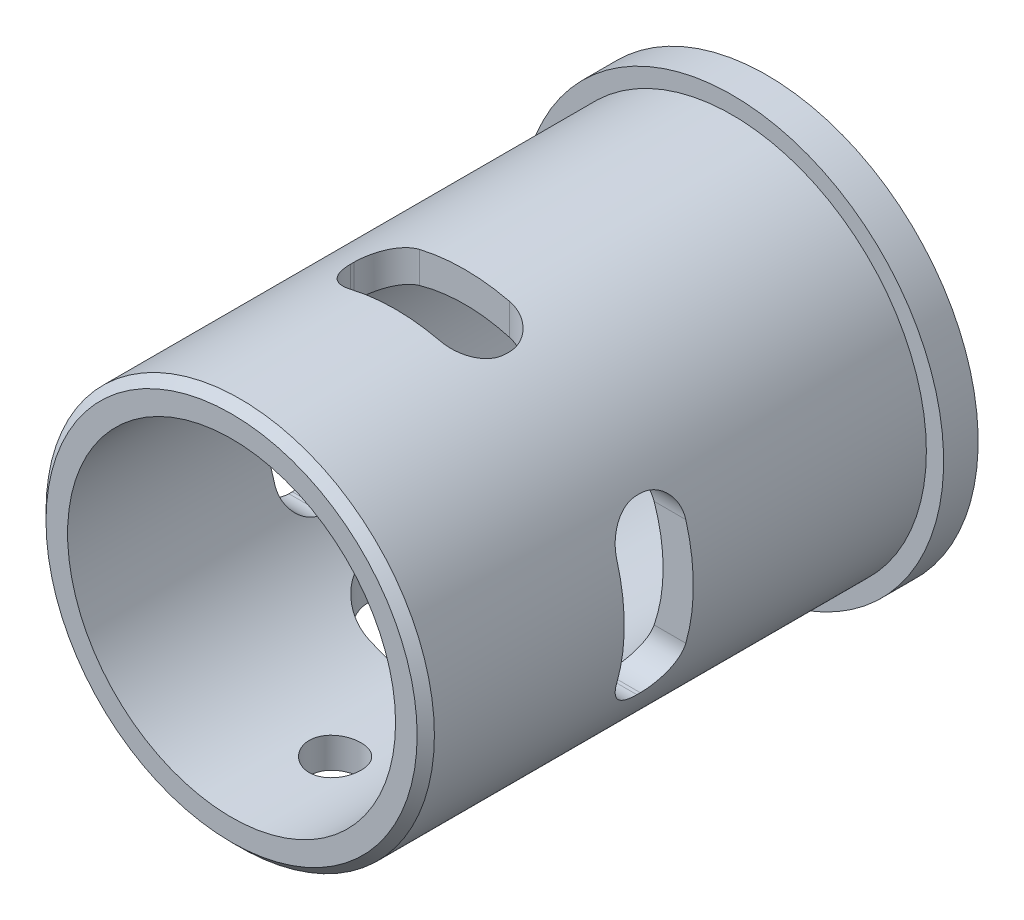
SolidWorks part; units mm, degrees
ref_plane "Face" through (0, 0, 0) normal (0, 0, 1) x (1, 0, 0)
ref_plane "Dessus" through (0, 0, 0) normal (0, 1, 0) x (1, 0, 0)
ref_plane "Droite" through (0, 0, 0) normal (1, 0, 0) x (0, 0, -1)
sketch "Esquisse1" plane through (0, 0, 0) normal (0, 0, 1) x (1, 0, 0)
  circle A0 centre (0, 0) radius 9.5
  circle A1 centre (0, 0) radius 11.25
  dimension "D1" = 19
  dimension "D2" = 22.5
extrude "Base-Extrusion" add sketch "Esquisse1" along normal blind 31
chamfer "Chanfrein1" distance 0.5 angle 45 1 edges at (11.25, 0, 31)
sketch "Esquisse2" plane through (0, 0, 0) normal (0, 0, -1) x (-1, 0, 0)
  circle A0 centre (0, 0) radius 11.25 construction
  circle A1 centre (0, 0) radius 11.25
extrude "Boss.-Extru.-Mince1" add sketch "Esquisse2" against normal blind 2 thin
sketch "Esquisse3" plane through (0, 0, 0) normal (0, 1, 0) x (1, 0, 0)
  line L0 (-12.25, -2) -> (12.25, -2) construction
  line L1 (-4.1, -14) -> (4.1, -14)
  line L2 (-6.5, -16.4) -> (-6.5, -16.6)
  line L3 (-4.1, -19) -> (4.1, -19)
  line L4 (6.5, -16.4) -> (6.5, -16.6)
  arc A0 (-6.5, -16.4) -> (-4.1, -14) centre (-4.1, -16.4) cw
  arc A1 (-4.1, -19) -> (-6.5, -16.6) centre (-4.1, -16.6) cw
  arc A2 (6.5, -16.6) -> (4.1, -19) centre (4.1, -16.6) cw
  arc A3 (4.1, -14) -> (6.5, -16.4) centre (4.1, -16.4) cw
  circle A4 centre (0, -25) radius 1.5
  dimension "D5" = 2.4
  dimension "D6" = 2.4
  dimension "D7" = 2.4
  dimension "D8" = 2.4
  dimension "D10" = 3
  dimension "D1" = 12
  dimension "D2" = 5
  dimension "D3" = 13
  dimension "D4" = 6.5
  dimension "D9" = 23
extrude "Enlèv. mat.-Extru.1" cut sketch "Esquisse3" against normal through all
sketch "Esquisse4" plane through (0, 0, 0) normal (1, 0, 0) x (0, 0, -1)
  line L0 (-2, 12.25) -> (-2, -12.25) construction
  line L1 (-17.6, 5) -> (-17.4, 5)
  line L2 (-19.5, 3.1) -> (-19.5, -3.1)
  line L3 (-17.6, -5) -> (-17.4, -5)
  line L4 (-15.5, 3.1) -> (-15.5, -3.1)
  arc A0 (-17.4, 5) -> (-15.5, 3.1) centre (-17.4, 3.1) cw
  arc A1 (-17.6, 5) -> (-19.5, 3.1) centre (-17.6, 3.1) ccw
  arc A2 (-19.5, -3.1) -> (-17.6, -5) centre (-17.6, -3.1) ccw
  arc A3 (-15.5, -3.1) -> (-17.4, -5) centre (-17.4, -3.1) cw
  dimension "D5" = 1.9
  dimension "D6" = 1.9
  dimension "D7" = 1.9
  dimension "D8" = 1.9
  dimension "D1" = 5
  dimension "D2" = 10
  dimension "D3" = 4
  dimension "D4" = 13.5
extrude "Enlèv. mat.-Extru.2" cut sketch "Esquisse4" against normal mid plane 50
sketch "Esquisse5" plane through (0, 0, 0) normal (0, 1, 0) x (1, 0, 0)
  line L0 (-12.25, -2) -> (12.25, -2) construction
  line L1 (-2.6, -17.5) -> (2.6, -17.5)
  line L2 (-4.5, -19.4) -> (-4.5, -19.6)
  line L3 (-2.6, -21.5) -> (2.6, -21.5)
  line L4 (4.5, -19.4) -> (4.5, -19.6)
  arc A0 (2.6, -17.5) -> (4.5, -19.4) centre (2.6, -19.4) cw
  arc A1 (4.5, -19.6) -> (2.6, -21.5) centre (2.6, -19.6) cw
  arc A2 (-4.5, -19.6) -> (-2.6, -21.5) centre (-2.6, -19.6) ccw
  arc A3 (-4.5, -19.4) -> (-2.6, -17.5) centre (-2.6, -19.4) cw
  dimension "D5" = 1.9
  dimension "D6" = 1.9
  dimension "D7" = 1.9
  dimension "D8" = 1.9
  dimension "D1" = 4
  dimension "D2" = 9
  dimension "D3" = 4.5
  dimension "D4" = 15.5
extrude "Enlèv. mat.-Extru.3" cut sketch "Esquisse5" along normal blind 50
sketch "Esquisse6" plane through (0, 0, 0) normal (0, 0, -1) x (-1, 0, 0)
  line L1 (0, 14.5735) -> (-14.7811, 14.5735)
  line L2 (0, 14.5735) -> (0, -14.4838)
  line L3 (0, -14.4838) -> (-14.7811, -14.4838)
  line L4 (-14.7811, 14.5735) -> (-14.7811, -14.4838)
extrude "Enlèv. mat.-Extru.4" [suppressed] cut sketch "Esquisse6" against normal through all
